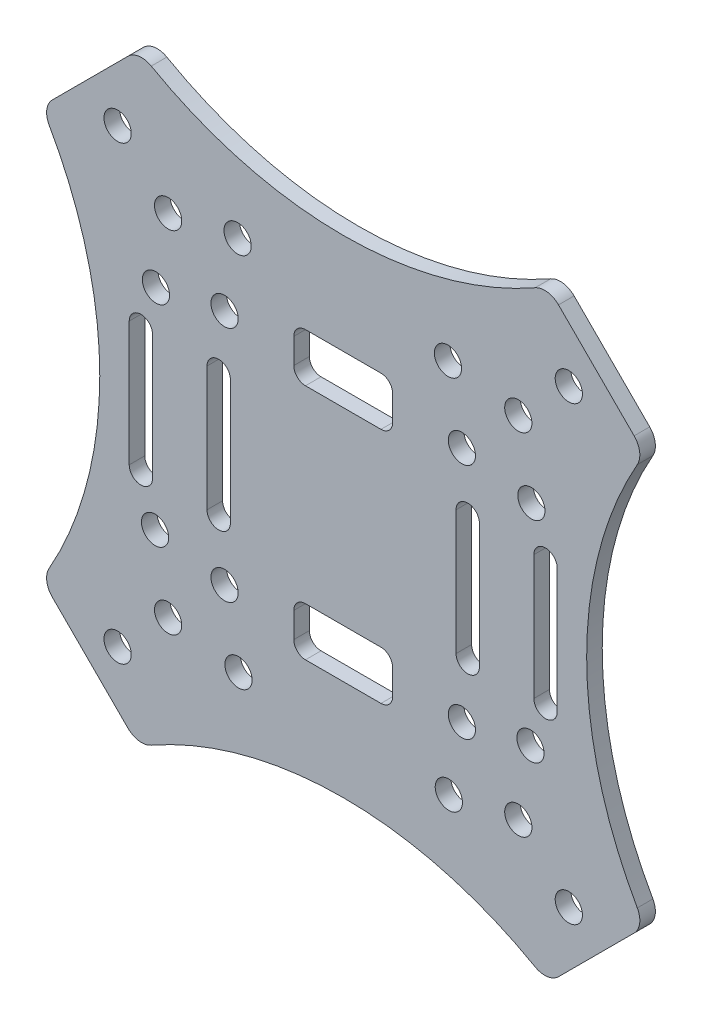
SolidWorks part; units mm, degrees
ref_plane "Front Plane" through (0, 0, 0) normal (0, 0, 1) x (1, 0, 0)
ref_plane "Top Plane" through (0, 0, 0) normal (0, 1, 0) x (1, 0, 0)
ref_plane "Right Plane" through (0, 0, 0) normal (1, 0, 0) x (0, 0, -1)
sketch "Sketch2" plane through (0, 0, 0) normal (0, 0, 1) x (1, 0, 0)
  line L0 (22.5, 22.5) -> (15.25, 15.25) construction
  line L1 (-88.3883, -88.3883) -> (88.3883, -88.3883) construction
  line L2 (-88.3883, -88.3883) -> (-88.3883, 88.3883) construction
  line L3 (88.3883, 88.3883) -> (80.3883, 88.3883) construction
  line L4 (88.3883, -88.3883) -> (88.3883, 88.3883) construction
  line L5 (-22.5, 22.5) -> (-15.25, 15.25) construction
  line L6 (-22.5, -22.5) -> (-15.25, -15.25) construction
  line L7 (15.25, -15.25) -> (22.5, -22.5) construction
  line L8 (-15.25, -15.25) -> (15.25, -15.25) construction
  line L9 (15.25, -15.25) -> (15.25, 15.25) construction
  line L10 (15.25, 15.25) -> (-15.25, 15.25) construction
  line L11 (-15.25, 15.25) -> (-15.25, -15.25) construction
  line L12 (0, 0) -> (28.9914, 28.9914) construction
  line L13 (18.875, 18.875) -> (24.1783, 13.5717) construction
  line L14 (18.875, 18.875) -> (13.4605, 24.0648) construction
  line L16 (16.1678, 21.4699) -> (16.4248, 21.727)
  line L17 (21.4699, 16.1678) -> (21.727, 16.4248)
  line L18 (19.4788, 26.484) -> (23.6395, 29.6392)
  line L19 (26.484, 19.4788) -> (29.6392, 23.6395)
  circle A0 centre (-22.5, 22.5) radius 1.75 construction
  circle A1 centre (22.5, 22.5) radius 1.75 construction
  circle A2 centre (22.5, -22.5) radius 1.75 construction
  circle A3 centre (-22.5, -22.5) radius 1.75 construction
  circle A4 centre (-15.25, 15.25) radius 1.75 construction
  circle A5 centre (15.25, 15.25) radius 1.75 construction
  circle A6 centre (15.25, -15.25) radius 1.75 construction
  circle A7 centre (-15.25, -15.25) radius 1.75 construction
  circle A8 centre (88.3883, 88.3883) radius 3.25
  circle A9 centre (13.4605, 24.0648) radius 1.75
  circle A10 centre (24.1783, 13.5717) radius 1.75
  circle A11 centre (28.9914, 28.9914) radius 1.75
  arc A12 (11.2589, 27.1004) -> (16.1678, 21.4699) centre (13.4605, 24.0648) ccw
  arc A13 (21.5267, 16.2233) -> (27.4519, 11.7425) centre (24.1783, 13.5717) ccw
  arc A14 (25.2432, 28.8737) -> (28.8737, 25.2432) centre (28.9914, 28.9914) ccw
  circle A15 centre (80.3883, 88.3883) radius 1.75
  circle A16 centre (88.3883, 96.3883) radius 1.75
  circle A17 centre (96.3883, 88.3883) radius 1.75
  circle A18 centre (88.3883, 80.3883) radius 1.75
  arc A19 (95.2099, 78.8213) -> (78.8213, 95.2099) centre (88.3883, 88.3883) ccw
  arc A20 (11.2589, 27.1004) -> (78.8213, 95.2099) centre (-163.3974, 267.9184) ccw
  arc A21 (27.1004, 11.2589) -> (95.2099, 78.8213) centre (267.9184, -163.3974) cw
  arc A22 (23.8811, 17.6945) -> (26.484, 19.4788) centre (22.5, 22.5) ccw
  arc A23 (19.4788, 26.484) -> (17.6945, 23.8811) centre (22.5, 22.5) ccw
  arc A24 (29.6392, 23.6395) -> (28.8737, 25.2432) centre (28.8424, 24.2437) ccw
  arc A25 (23.6395, 29.6392) -> (25.2432, 28.8737) centre (24.2437, 28.8424) cw
  arc A26 (23.8811, 17.6945) -> (21.727, 16.4248) centre (25.2623, 12.8891) ccw
  arc A27 (16.4248, 21.727) -> (17.6945, 23.8811) centre (12.8891, 25.2623) ccw
  point P0 (0, 0)
  point P6 (0, 0)
  point P15 (0, 0)
  point P39 (83.085, 93.6916)
  point P40 (23.6881, 34.2947)
  point P47 (93.6916, 83.085)
  point P48 (34.2947, 23.6881)
  point P63 (31.9794, 26.7255)
  point P66 (26.7255, 31.9794)
  dimension "D1" = 4
sketch "Sketch3" plane through (0, 0, 0) normal (0, 0, 1) x (1, 0, 0)
  line L0 (32.5269, -32.5269) -> (37.3859, -27.668)
  line L1 (32.5269, 32.5269) -> (37.3859, 27.668)
  line L2 (32.5269, 32.5269) -> (27.668, 37.3859)
  line L3 (32.5269, -32.5269) -> (27.668, -37.3859)
  line L4 (-32.5269, -32.5269) -> (-27.668, -37.3859)
  line L5 (-32.5269, -32.5269) -> (-37.3859, -27.668)
  line L6 (-32.5269, 32.5269) -> (-37.3859, 27.668)
  line L7 (-32.5269, 32.5269) -> (-27.668, 37.3859)
  line L8 (0, 0) -> (16, 0) construction
  line L9 (16, 0) -> (16, 8) construction
  line L10 (16, 0) -> (16, -8) construction
  line L11 (17.5, 0) -> (17.5, -8)
  line L12 (17.5, 0) -> (17.5, 8)
  line L13 (14.5, 0) -> (14.5, -8)
  line L14 (14.5, 0) -> (14.5, 8)
  line L15 (0, 0) -> (0, 13.4605) construction
  line L16 (24.5, 0) -> (24.5, -8)
  line L17 (27.5, 0) -> (27.5, -8)
  line L18 (27.5, 0) -> (27.5, 8)
  line L19 (24.5, 0) -> (24.5, 8)
  line L20 (-27.5, 0) -> (-27.5, -8)
  line L21 (-24.5, 0) -> (-24.5, -8)
  line L22 (-27.5, 0) -> (-27.5, 8)
  line L23 (-24.5, 0) -> (-24.5, 8)
  line L24 (-14.5, 0) -> (-14.5, 8)
  line L25 (-17.5, 0) -> (-17.5, 8)
  line L26 (-17.5, 0) -> (-17.5, -8)
  line L27 (-14.5, 0) -> (-14.5, -8)
  line L28 (0, 15.25) -> (6.35, 15.25) construction
  line L29 (15.25, 15.25) -> (-15.25, 15.25) construction
  line L30 (0, 15.25) -> (-6.35, 15.25) construction
  line L31 (0, 18.375) -> (4.85, 18.375)
  line L32 (0, 18.375) -> (-4.85, 18.375)
  line L33 (0, 12.125) -> (4.85, 12.125)
  line L34 (0, 12.125) -> (-4.85, 12.125)
  line L35 (6.35, 16.875) -> (6.35, 13.625)
  line L36 (-6.35, 16.875) -> (-6.35, 13.625)
  line L37 (0, -18.375) -> (4.85, -18.375)
  line L38 (6.35, -16.875) -> (6.35, -13.625)
  line L39 (0, -12.125) -> (4.85, -12.125)
  line L40 (0, -12.125) -> (-4.85, -12.125)
  line L41 (-6.35, -16.875) -> (-6.35, -13.625)
  line L42 (0, -18.375) -> (-4.85, -18.375)
  line L43 (0, 18.375) -> (6.35, 18.375) construction
  line L44 (0, 12.125) -> (6.35, 12.125) construction
  line L45 (0, 12.125) -> (-6.35, 12.125) construction
  line L46 (0, 18.375) -> (-6.35, 18.375) construction
  circle A0 centre (28.9914, 28.9914) radius 1.75
  circle A1 centre (24.1783, 13.5717) radius 1.75
  circle A2 centre (22.5, 22.5) radius 1.75
  circle A3 centre (13.4605, 24.0648) radius 1.75
  circle A4 centre (15.25, 15.25) radius 1.75
  circle A5 centre (-15.25, 15.25) radius 1.75
  circle A6 centre (-22.5, 22.5) radius 1.75
  circle A7 centre (-15.25, -15.25) radius 1.75
  circle A8 centre (15.25, -15.25) radius 1.75
  circle A9 centre (22.5, -22.5) radius 1.75
  circle A10 centre (-22.5, -22.5) radius 1.75
  circle A11 centre (24.0648, -13.4605) radius 1.75
  circle A12 centre (13.5717, -24.1783) radius 1.75
  circle A13 centre (28.9914, -28.9914) radius 1.75
  circle A14 centre (-13.4605, -24.0648) radius 1.75
  circle A15 centre (-24.1783, -13.5717) radius 1.75
  circle A16 centre (-28.9914, -28.9914) radius 1.75
  circle A17 centre (-24.0648, 13.4605) radius 1.75
  circle A18 centre (-13.5717, 24.1783) radius 1.75
  circle A19 centre (-28.9914, 28.9914) radius 1.75
  arc A20 (95.2099, 78.8213) -> (27.1004, 11.2589) centre (267.9184, -163.3974) ccw construction
  arc A21 (11.2589, 27.1004) -> (78.8213, 95.2099) centre (-163.3974, 267.9184) ccw construction
  arc A22 (-24.6669, 37.7927) -> (24.6669, 37.7927) centre (0, 81.2846) ccw
  arc A23 (37.7927, 24.6669) -> (37.7927, -24.6669) centre (81.2846, 0) ccw
  arc A24 (24.6669, -37.7927) -> (-24.6669, -37.7927) centre (0, -81.2846) ccw
  arc A25 (-37.7927, -24.6669) -> (-37.7927, 24.6669) centre (-81.2846, 0) ccw
  arc A26 (-37.3859, -27.668) -> (-37.7927, -24.6669) centre (-35.6181, -25.9002) cw
  arc A27 (-27.668, -37.3859) -> (-24.6669, -37.7927) centre (-25.9002, -35.6181) ccw
  arc A28 (27.668, -37.3859) -> (24.6669, -37.7927) centre (25.9002, -35.6181) cw
  arc A29 (37.3859, -27.668) -> (37.7927, -24.6669) centre (35.6181, -25.9002) ccw
  arc A30 (37.3859, 27.668) -> (37.7927, 24.6669) centre (35.6181, 25.9002) cw
  arc A31 (27.668, 37.3859) -> (24.6669, 37.7927) centre (25.9002, 35.6181) ccw
  arc A32 (-37.3859, 27.668) -> (-37.7927, 24.6669) centre (-35.6181, 25.9002) ccw
  arc A33 (-27.668, 37.3859) -> (-24.6669, 37.7927) centre (-25.9002, 35.6181) cw
  arc A34 (17.5, -8) -> (14.5, -8) centre (16, -8) cw
  arc A35 (17.5, 8) -> (14.5, 8) centre (16, 8) ccw
  arc A36 (27.5, -8) -> (24.5, -8) centre (26, -8) cw
  arc A37 (27.5, 8) -> (24.5, 8) centre (26, 8) ccw
  arc A38 (-27.5, -8) -> (-24.5, -8) centre (-26, -8) ccw
  arc A39 (-27.5, 8) -> (-24.5, 8) centre (-26, 8) cw
  arc A40 (-17.5, 8) -> (-14.5, 8) centre (-16, 8) cw
  arc A41 (-17.5, -8) -> (-14.5, -8) centre (-16, -8) ccw
  arc A42 (4.85, -12.125) -> (6.35, -13.625) centre (4.85, -13.625) cw
  arc A43 (4.85, -18.375) -> (6.35, -16.875) centre (4.85, -16.875) ccw
  arc A44 (-4.85, -18.375) -> (-6.35, -16.875) centre (-4.85, -16.875) cw
  arc A45 (-4.85, -12.125) -> (-6.35, -13.625) centre (-4.85, -13.625) ccw
  arc A46 (4.85, 18.375) -> (6.35, 16.875) centre (4.85, 16.875) cw
  arc A47 (4.85, 12.125) -> (6.35, 13.625) centre (4.85, 13.625) ccw
  arc A48 (-4.85, 12.125) -> (-6.35, 13.625) centre (-4.85, 13.625) cw
  arc A49 (-4.85, 18.375) -> (-6.35, 16.875) centre (-4.85, 16.875) ccw
  point P84 (38.7579, 26.296)
  point P87 (26.296, 38.7579)
  point P147 (6.35, -12.125)
  point P150 (6.35, -18.375)
  point P153 (-6.35, -18.375)
  point P156 (-6.35, -12.125)
  point P160 (6.35, 18.375)
  point P164 (6.35, 12.125)
  point P168 (-6.35, 12.125)
  point P172 (-6.35, 18.375)
  dimension "D2" = 4
  dimension "D3" = 4
  dimension "D4" = 2.5
  dimension "D1" = 2
extrude "Boss-Extrude1" add sketch "Sketch3" along normal blind 2
